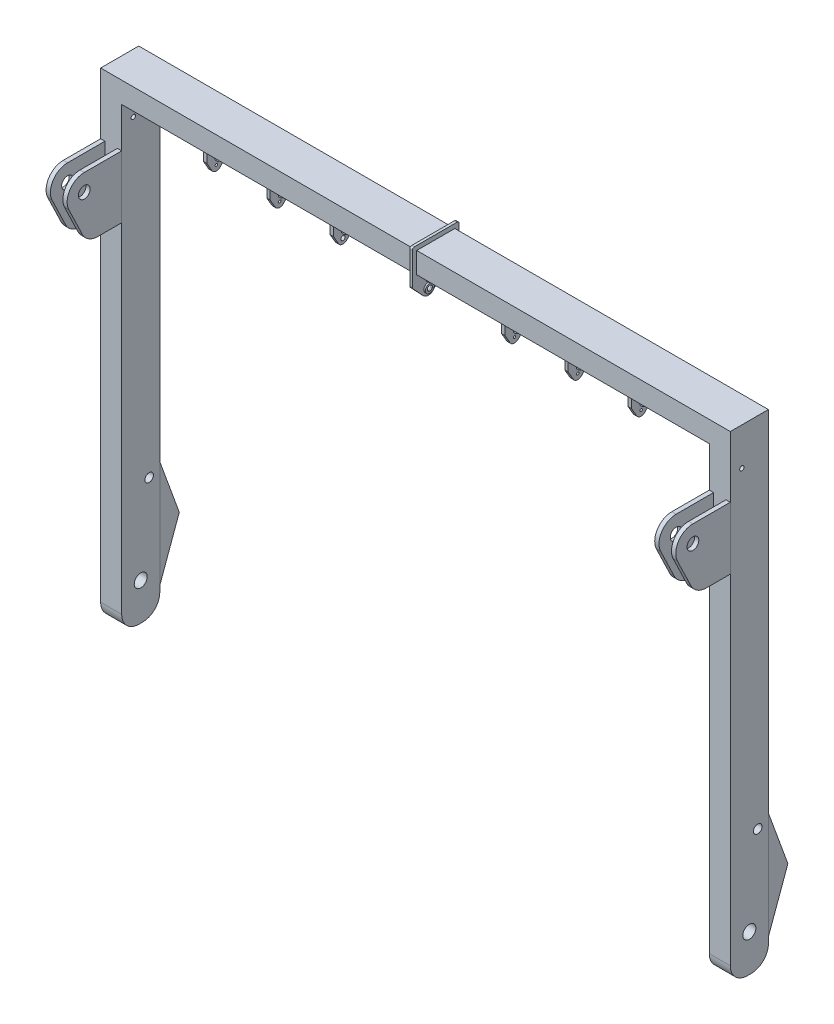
SolidWorks part; units mm, degrees
ref_plane "Front Plane" through (0, 0, 0) normal (0, 0, 1) x (1, 0, 0)
ref_plane "Top Plane" through (0, 0, 0) normal (0, 1, 0) x (1, 0, 0)
ref_plane "Right Plane" through (0, 0, 0) normal (1, 0, 0) x (0, 0, -1)
sketch "Sketch1" plane through (0, 0, 0) normal (0, 0, 1) x (1, 0, 0)
  line L0 (-3730, 0) -> (-3730, 5684.8)
  line L1 (-3730, 5684.8) -> (3730, 5684.8)
  line L2 (3730, 5684.8) -> (3730, 0)
  line L3 (-3480.7, 0) -> (-3480.7, 5435.5)
  line L4 (-3480.7, 5435.5) -> (3480.7, 5435.5)
  line L5 (3480.7, 5435.5) -> (3480.7, 0)
  line L6 (-3480.7, 0) -> (-3730, 0)
  line L7 (3480.7, 0) -> (3730, 0)
  line L8 (0, 5435.5) -> (0, 0) construction
  line L9 (0, 0) -> (-3480.7, 0) construction
  dimension "D1" = 5684.8
  dimension "D2" = 7460
  dimension "D3" = 249.3
extrude "Boss-Extrude1" add sketch "Sketch1" along normal mid plane 451.3
ref_plane "Plane1" through (-0.01, 0, 0) normal (-1, 0, 0) x (0, 0, 1)
sketch "Sketch13" plane through (-0.01, 0, 0) normal (-1, 0, 0) x (0, 0, 1)
  line L0 (-200.35, 5435.5) -> (-200.35, 5387.4)
  line L2 (201.65, 5435.5) -> (201.65, 5310.7)
  line L3 (201.65, 5310.7) -> (144.0049, 5210.8558)
  line L4 (201.65, 5435.5) -> (-200.35, 5435.5)
  line L5 (-200.35, 5387.4) -> (-57.6508, 5305.0126)
  line L6 (-57.6508, 5305.0126) -> (42.165, 5196.5723)
  line L7 (89.6275, 5176.4) -> (360.1297, 5176.4) construction
  line L8 (225.65, 5435.5) -> (-225.65, 5435.5) construction
  line L9 (225.65, 5435.5) -> (-225.65, 5435.5) construction
  circle A0 centre (88.15, 5238.9) radius 14.5
  arc A3 (42.165, 5196.5723) -> (144.0049, 5210.8558) centre (88.15, 5238.9) ccw
  dimension "D1" = 29
  dimension "D2" = 113.5
  dimension "D8" = 259.1
  dimension "D9" = 24
  dimension "D10" = 125
  dimension "D11" = 196.6
  dimension "D3" = 124.8
  dimension "D4" = 30
  dimension "D5" = 48.1
  dimension "D6" = 402
  dimension "D7" = 30
extrude "Boss-Extrude11" add sketch "Sketch13" along normal mid plane 40 from offset 1016
sketch "Sketch7" plane through (-0.01, 0, 0) normal (-1, 0, 0) x (0, 0, 1)
  line L0 (278.15, 5321.682) -> (148.4867, 5182.6351)
  line L1 (-51.5359, 5294.5578) -> (-277.25, 5399.81)
  line L2 (-51.5359, 5294.5578) -> (20.57, 5191.5799)
  line L3 (225.65, 5435.5) -> (-225.65, 5435.5) construction
  line L4 (225.65, 0) -> (225.65, 5684.8) construction
  line L5 (88.15, 5156.4) -> (-488.2969, 5156.4) construction
  line L6 (-277.25, 5399.81) -> (-277.25, 5736.4)
  line L7 (278.15, 5321.682) -> (278.15, 5736.4)
  line L8 (278.15, 5736.4) -> (-277.25, 5736.4)
  line L9 (-225.65, 0) -> (-225.65, 5684.8) construction
  line L11 (225.65, 5684.8) -> (-225.65, 5684.8) construction
  arc A0 (20.57, 5191.5799) -> (148.4867, 5182.6351) centre (88.15, 5238.9) ccw
  circle A1 centre (88.15, 5238.9) radius 14.5 construction
  circle A2 centre (88.15, 5238.9) radius 14.5 construction
  circle A5 centre (88.15, 5238.9) radius 26
  point P16 (371.3203, 5138.9139)
  dimension "D3" = 190
  dimension "D8" = 52
  dimension "D12" = 150
  dimension "D13" = 82.5
  dimension "D2" = 497.5
  dimension "D4" = 51.6
  dimension "D5" = 51.6
  dimension "D6" = 52.5
  dimension "D7" = 296.5861
  dimension "D9" = 336.59
  dimension "D10" = 43
  dimension "D11" = 115
  dimension "D15" = 580
extrude "Boss-Extrude6" add sketch "Sketch7" along normal mid plane 30
sketch "Sketch2" plane through (3730, 0, 0) normal (1, 0, 0) x (0, 0, -1)
  circle A0 centre (0, 439.1094) radius 76.9825
  circle A1 centre (-88.15, 5238.9) radius 26 construction
  circle A2 centre (-88.15, 5238.9) radius 26
  dimension "D2" = 153.965
  dimension "D1" = 4800.6
extrude "Cut-Extrude1" cut sketch "Sketch2" against normal through all
fillet "Fillet1" radius 203.2 4 edges at (3605.35, 0, -225.65) (3605.35, 0, 225.65) (-3605.35, 0, -225.65) (-3605.35, 0, 225.65)
sketch "Sketch3" plane through (-3730, 0, 0) normal (-1, 0, 0) x (0, 0, 1)
  line L0 (225.65, 4959.1273) -> (668.7246, 4959.1273)
  line L1 (225.65, 5684.8) -> (225.65, 203.2) construction
  line L2 (851.8953, 4667.9572) -> (692.845, 4336.7839)
  line L3 (509.6743, 4221.554) -> (225.65, 4221.554)
  line L4 (225.65, 4221.554) -> (225.65, 4959.1273)
  arc A0 (692.845, 4336.7839) -> (509.6743, 4221.554) centre (509.6743, 4424.754) cw
  arc A1 (668.7246, 4959.1273) -> (851.8953, 4667.9572) centre (668.7246, 4755.9273) cw
  circle A2 centre (668.7246, 4755.9273) radius 69.7806
  dimension "D1" = 203.2
extrude "Boss-Extrude2" add sketch "Sketch3" against normal blind 50.8 separate body
sketch "Sketch4" plane through (-3480.7, 0, 0) normal (1, 0, 0) x (0, 0, -1)
  line L4 (-225.65, 4221.554) -> (-225.65, 4959.1273)
  line L5 (-225.65, 4959.1273) -> (-668.7246, 4959.1273)
  line L6 (-851.8953, 4667.9572) -> (-692.845, 4336.7839)
  line L7 (-509.6743, 4221.554) -> (-225.65, 4221.554)
  line L8 (-225.65, 4221.554) -> (-225.65, 4959.1273)
  line L9 (-225.65, 4959.1273) -> (-668.7246, 4959.1273)
  line L10 (-851.8953, 4667.9572) -> (-692.845, 4336.7839)
  line L11 (-509.6743, 4221.554) -> (-225.65, 4221.554)
  circle A0 centre (-668.7246, 4755.9273) radius 69.7806 construction
  circle A1 centre (-668.7246, 4755.9273) radius 69.7806
  arc A2 (-668.7246, 4959.1273) -> (-851.8953, 4667.9572) centre (-668.7246, 4755.9273) ccw
  arc A3 (-692.845, 4336.7839) -> (-509.6743, 4221.554) centre (-509.6743, 4424.754) ccw
  arc A4 (-668.7246, 4959.1273) -> (-851.8953, 4667.9572) centre (-668.7246, 4755.9273) ccw
  arc A5 (-692.845, 4336.7839) -> (-509.6743, 4221.554) centre (-509.6743, 4424.754) ccw
  dimension "D1" = 0
extrude "Boss-Extrude3" add sketch "Sketch4" against normal blind 50.8 separate body
sketch "Sketch5" plane through (3730, 0, 0) normal (1, 0, 0) x (0, 0, -1)
  line L4 (-509.6743, 4221.554) -> (-225.65, 4221.554)
  line L5 (-225.65, 4221.554) -> (-225.65, 4959.1273)
  line L6 (-225.65, 4959.1273) -> (-668.7246, 4959.1273)
  line L7 (-851.8953, 4667.9572) -> (-692.845, 4336.7839)
  line L8 (-509.6743, 4221.554) -> (-225.65, 4221.554)
  line L9 (-225.65, 4221.554) -> (-225.65, 4959.1273)
  line L10 (-225.65, 4959.1273) -> (-668.7246, 4959.1273)
  line L11 (-851.8953, 4667.9572) -> (-692.845, 4336.7839)
  circle A0 centre (-668.7246, 4755.9273) radius 69.7806 construction
  circle A1 centre (-668.7246, 4755.9273) radius 69.7806
  arc A2 (-668.7246, 4959.1273) -> (-851.8953, 4667.9572) centre (-668.7246, 4755.9273) ccw
  arc A3 (-692.845, 4336.7839) -> (-509.6743, 4221.554) centre (-509.6743, 4424.754) ccw
  arc A4 (-668.7246, 4959.1273) -> (-851.8953, 4667.9572) centre (-668.7246, 4755.9273) ccw
  arc A5 (-692.845, 4336.7839) -> (-509.6743, 4221.554) centre (-509.6743, 4424.754) ccw
  dimension "D1" = 0
extrude "Boss-Extrude4" add sketch "Sketch5" against normal blind 50.8 separate body
sketch "Sketch6" plane through (3480.7, 0, 0) normal (-1, 0, 0) x (0, 0, 1)
  line L4 (692.845, 4336.7839) -> (851.8953, 4667.9572)
  line L5 (668.7246, 4959.1273) -> (225.65, 4959.1273)
  line L6 (225.65, 4959.1273) -> (225.65, 4221.554)
  line L7 (225.65, 4221.554) -> (509.6743, 4221.554)
  line L8 (692.845, 4336.7839) -> (851.8953, 4667.9572)
  line L9 (668.7246, 4959.1273) -> (225.65, 4959.1273)
  line L10 (225.65, 4959.1273) -> (225.65, 4221.554)
  line L11 (225.65, 4221.554) -> (509.6743, 4221.554)
  circle A0 centre (668.7246, 4755.9273) radius 69.7806 construction
  circle A1 centre (668.7246, 4755.9273) radius 69.7806
  arc A2 (509.6743, 4221.554) -> (692.845, 4336.7839) centre (509.6743, 4424.754) ccw
  arc A3 (851.8953, 4667.9572) -> (668.7246, 4959.1273) centre (668.7246, 4755.9273) ccw
  arc A4 (509.6743, 4221.554) -> (692.845, 4336.7839) centre (509.6743, 4424.754) ccw
  arc A5 (851.8953, 4667.9572) -> (668.7246, 4959.1273) centre (668.7246, 4755.9273) ccw
  dimension "D1" = 0
extrude "Boss-Extrude5" add sketch "Sketch6" against normal blind 50.8 separate body
sketch "Sketch8" plane through (-3730, 0, 0) normal (-1, 0, 0) x (0, 0, 1)
  line L0 (-225.65, 1544.4774) -> (-456.7711, 909.4774)
  line L1 (-225.65, 5684.8) -> (-225.65, 203.2) construction
  line L2 (-456.7711, 909.4774) -> (-225.65, 274.4774)
  line L3 (-225.65, 274.4774) -> (-225.65, 1544.4774)
  dimension "D1" = 20
  dimension "D2" = 1270
extrude "Boss-Extrude7" add sketch "Sketch8" against normal up to surface (249.3 mm away) separate body
sketch "Sketch9" plane through (3730, 0, 0) normal (1, 0, 0) x (0, 0, -1)
  line L3 (225.65, 1544.4774) -> (225.65, 274.4774)
  line L4 (225.65, 274.4774) -> (456.7711, 909.4774)
  line L5 (456.7711, 909.4774) -> (225.65, 1544.4774)
  line L6 (225.65, 1544.4774) -> (225.65, 274.4774)
  line L7 (225.65, 274.4774) -> (456.7711, 909.4774)
  line L8 (456.7711, 909.4774) -> (225.65, 1544.4774)
  dimension "D1" = 0
extrude "Boss-Extrude8" add sketch "Sketch9" against normal up to surface (249.3 mm away) separate body
sketch "Sketch10" plane through (-3730, 0, 0) normal (-1, 0, 0) x (0, 0, 1)
  circle A0 centre (-100, 1444.1094) radius 50.8
  circle A1 centre (0, 439.1094) radius 76.9825 construction
  dimension "D2" = 100
  dimension "D3" = 101.6
  dimension "D1" = 1005
extrude "Cut-Extrude2" cut sketch "Sketch10" against normal through all
sketch "Sketch11" plane through (-15.01, 0, 0) normal (-1, 0, 0) x (0, 0, 1)
  circle A0 centre (88.15, 5238.9) radius 52.5
  circle A1 centre (88.15, 5238.9) radius 26 construction
  circle A2 centre (88.15, 5238.9) radius 26
  dimension "D1" = 105
extrude "Boss-Extrude9" add sketch "Sketch11" along normal blind 18 separate body
sketch "Sketch12" plane through (14.99, 0, 0) normal (1, 0, 0) x (0, 0, -1)
  circle A1 centre (-88.15, 5238.9) radius 26
  circle A2 centre (-88.15, 5238.9) radius 26
  circle A3 centre (-88.15, 5238.9) radius 52.5
  circle A4 centre (-88.15, 5238.9) radius 52.5
  dimension "D1" = 0
  dimension "D2" = 0
extrude "Boss-Extrude10" add sketch "Sketch12" along normal blind 18 separate body
pattern_linear "LPattern1" count 3 spacing 750 along (-1, 0, 0) of "Boss-Extrude11"
sketch "Sketch15" plane through (-0.01, 0, 0) normal (-1, 0, 0) x (0, 0, 1)
  line L6 (-200.35, 5435.5) -> (-200.35, 5387.4)
  line L7 (-200.35, 5387.4) -> (-57.6508, 5305.0126)
  line L8 (-57.6508, 5305.0126) -> (42.165, 5196.5723)
  line L9 (144.0049, 5210.8558) -> (201.65, 5310.7)
  line L10 (201.65, 5310.7) -> (201.65, 5435.5)
  line L11 (201.65, 5435.5) -> (-200.35, 5435.5)
  line L12 (-200.35, 5435.5) -> (-200.35, 5387.4)
  line L13 (-200.35, 5387.4) -> (-57.6508, 5305.0126)
  line L14 (-57.6508, 5305.0126) -> (42.165, 5196.5723)
  line L15 (144.0049, 5210.8558) -> (201.65, 5310.7)
  line L16 (201.65, 5310.7) -> (201.65, 5435.5)
  line L17 (201.65, 5435.5) -> (-200.35, 5435.5)
  circle A1 centre (88.15, 5238.9) radius 14.5
  circle A2 centre (88.15, 5238.9) radius 14.5
  arc A3 (42.165, 5196.5723) -> (144.0049, 5210.8558) centre (88.15, 5238.9) ccw
  arc A4 (42.165, 5196.5723) -> (144.0049, 5210.8558) centre (88.15, 5238.9) ccw
  dimension "D1" = 0
  dimension "D2" = 0
extrude "Boss-Extrude12" add sketch "Sketch15" along normal mid plane 40 from offset 1016
pattern_linear "LPattern2" count 3 spacing 750 along (1, 0, 0) of "Boss-Extrude12"
sketch "Sketch16" plane through (0, 0, 225.65) normal (0, 0, 1) x (1, 0, 0)
  line L0 (14.99, 5395.5) -> (14.99, 5315.5)
  line L1 (14.99, 5321.682) -> (14.99, 5736.4) construction
  line L2 (14.99, 5315.5) -> (54.99, 5315.5)
  line L3 (54.99, 5315.5) -> (214.99, 5395.5)
  line L4 (214.99, 5395.5) -> (214.99, 5435.5)
  line L5 (14.99, 5435.5) -> (3480.7, 5435.5) construction
  line L6 (214.99, 5435.5) -> (54.99, 5435.5)
  line L7 (-15.01, 5736.4) -> (14.99, 5736.4) construction
  line L8 (-15.01, 5736.4) -> (14.99, 5736.4) construction
  line L9 (-0.01, 5736.4) -> (-0.01, 1135.9084) construction
  line L10 (-215.01, 5435.5) -> (-55.01, 5435.5)
  line L11 (-215.01, 5395.5) -> (-215.01, 5435.5)
  line L12 (-55.01, 5315.5) -> (-215.01, 5395.5)
  line L13 (-15.01, 5315.5) -> (-55.01, 5315.5)
  line L14 (-15.01, 5395.5) -> (-15.01, 5315.5)
  arc A0 (14.99, 5395.5) -> (54.99, 5435.5) centre (14.99, 5435.5) ccw
  arc A1 (-15.01, 5395.5) -> (-55.01, 5435.5) centre (-15.01, 5435.5) cw
  dimension "D5" = 80
  dimension "D1" = 120
  dimension "D2" = 40
  dimension "D3" = 40
  dimension "D4" = 200
extrude "Boss-Extrude14" add sketch "Sketch16" along normal mid plane 25 from offset 125
sketch "Sketch17" plane through (0, 0, 225.65) normal (0, 0, 1) x (1, 0, 0)
  line L0 (995.99, 5295.5) -> (970.59, 5295.5)
  line L1 (995.99, 5210.8558) -> (995.99, 5310.7) construction
  line L2 (970.59, 5295.5) -> (767.39, 5410.1)
  line L3 (767.39, 5410.1) -> (767.39, 5435.5)
  line L4 (14.99, 5435.5) -> (3480.7, 5435.5) construction
  line L5 (767.39, 5435.5) -> (995.99, 5435.5)
  line L6 (995.99, 5435.5) -> (995.99, 5295.5)
  line L7 (995.99, 5435.5) -> (1035.99, 5435.5) construction
  line L8 (1015.99, 5435.5) -> (1015.99, 5158.3177) construction
  line L9 (1035.99, 5435.5) -> (1035.99, 5295.5)
  line L10 (1264.59, 5435.5) -> (1035.99, 5435.5)
  line L11 (1264.59, 5410.1) -> (1264.59, 5435.5)
  line L12 (1061.39, 5295.5) -> (1264.59, 5410.1)
  line L13 (1035.99, 5295.5) -> (1061.39, 5295.5)
  dimension "D1" = 140
  dimension "D2" = 228.6
  dimension "D3" = 25.4
  dimension "D4" = 25.4
extrude "Boss-Extrude15" add sketch "Sketch17" along normal mid plane 25 from offset 135
pattern_linear "LPattern3" count 3 spacing 750 along (1, 0, 0) of "Boss-Extrude15"
sketch "Sketch18" plane through (0, 0, 225.65) normal (0, 0, 1) x (1, 0, 0)
  line L0 (-996.01, 5435.5) -> (-996.01, 5295.5)
  line L2 (-996.01, 5295.5) -> (-970.61, 5295.5)
  line L3 (-970.61, 5295.5) -> (-767.41, 5410.1)
  line L4 (-767.41, 5410.1) -> (-767.41, 5435.5)
  line L5 (-3480.7, 5435.5) -> (-15.01, 5435.5) construction
  line L6 (-767.41, 5435.5) -> (-996.01, 5435.5)
  line L7 (-996.01, 5435.5) -> (-1036.01, 5435.5) construction
  line L8 (-1016.01, 5435.5) -> (-1016.01, 5123.7679) construction
  line L9 (-1264.61, 5435.5) -> (-1036.01, 5435.5)
  line L10 (-1264.61, 5410.1) -> (-1264.61, 5435.5)
  line L11 (-1061.41, 5295.5) -> (-1264.61, 5410.1)
  line L12 (-1036.01, 5295.5) -> (-1061.41, 5295.5)
  line L13 (-1036.01, 5435.5) -> (-1036.01, 5295.5)
  dimension "D1" = 140
  dimension "D2" = 25.4
  dimension "D3" = 25.4
  dimension "D4" = 228.6
extrude "Boss-Extrude16" add sketch "Sketch18" along normal mid plane 25 from offset 135
pattern_linear "LPattern6" count 3 spacing 750 along (-1, 0, 0) of "Boss-Extrude16"
fillet "Fillet2" radius 25 4 edges at (-0.01, 5736.4, 278.15) (-0.01, 5736.4, -277.25) (-0.01, 5399.81, -277.25) (-0.01, 5321.682, 278.15)
sketch "Sketch20" plane through (-0.01, 0, 0) normal (-1, 0, 0) x (0, 0, 1)
  circle A0 centre (88.15, 5238.9) radius 29.964
  dimension "D1" = 59.928
extrude "Cut-Extrude3" cut sketch "Sketch20" against normal mid plane 76.2
sketch "Sketch21" plane through (0, 0, 225.65) normal (0, 0, 1) x (1, 0, 0)
  line L1 (-3730, 5684.8) -> (-717.4465, 5684.8)
  line L2 (-3730, 5684.8) -> (-3730, 4003.0192)
  line L3 (-3730, 4003.0192) -> (-717.4465, 4003.0192)
  line L4 (-717.4465, 5684.8) -> (-717.4465, 4003.0192)
extrude "Cut-Extrude4" [suppressed] cut sketch "Sketch21" against normal mid plane 12700
chamfer "Chamfer1" distance 1.27 angle 15 1 edges at (-33.01, 5238.9, 118.114)
chamfer "Chamfer2" distance 1.27 angle 15 1 edges at (32.99, 5238.9, 58.186)
fillet "Fillet3" radius 0.127 2 edges at (32.99, 5238.9, 57.8457) (31.72, 5238.9, 58.186)
fillet "Fillet4" radius 0.127 2 edges at (-33.01, 5238.9, 118.4543) (-31.74, 5238.9, 118.114)
